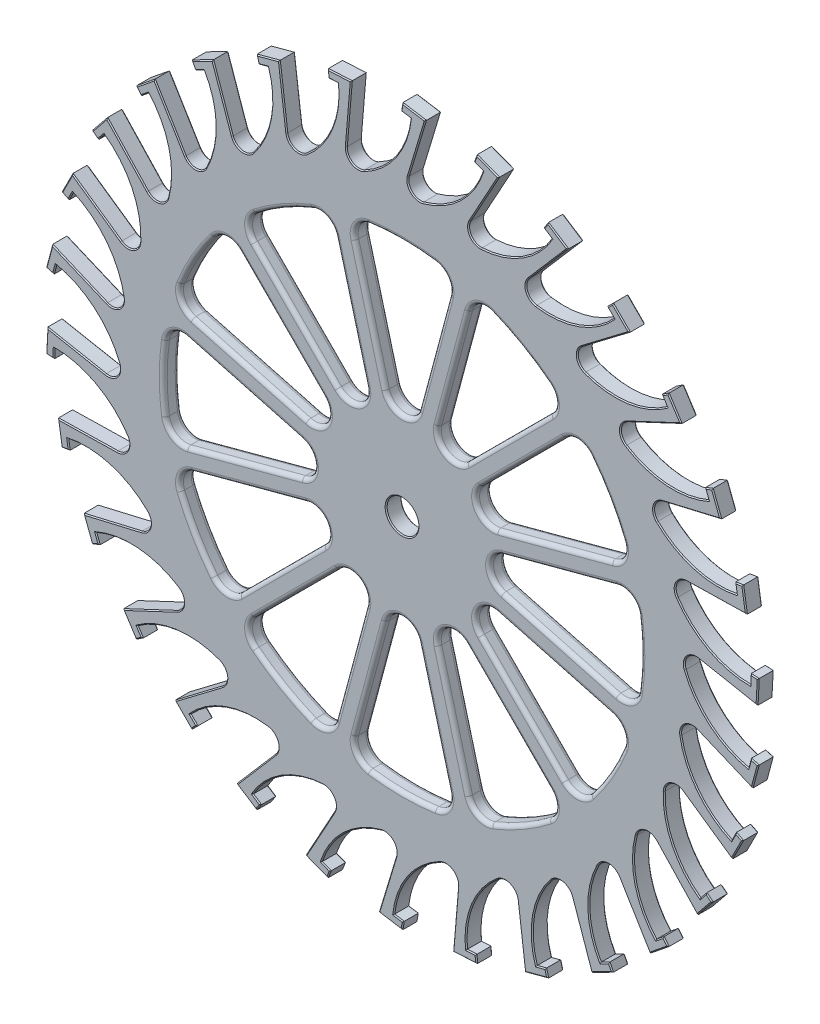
SolidWorks part; units mm, degrees
ref_plane "Спереди" through (0, 0, 0) normal (0, 0, 1) x (1, 0, 0)
ref_plane "Сверху" through (0, 0, 0) normal (0, 1, 0) x (1, 0, 0)
ref_plane "Справа" through (0, 0, 0) normal (1, 0, 0) x (0, 0, -1)
sketch "Эскиз1" plane through (0, 0, 0) normal (0, 0, 1) x (1, 0, 0)
  line L0 (0, 0) -> (0, -90) construction
  line L1 (-4.1625, -25.194) -> (-11.8833, -54.0084)
  line L2 (4.1625, -25.194) -> (11.8833, -54.0084)
  line L3 (-16.2019, -19.7374) -> (-37.2955, -40.831)
  line L4 (-8.9922, -23.8999) -> (-16.713, -52.7143)
  line L5 (-23.8999, -8.9922) -> (-52.7143, -16.713)
  line L6 (-19.7374, -16.2019) -> (-40.831, -37.2955)
  line L7 (-25.194, 4.1625) -> (-54.0084, 11.8833)
  line L8 (-25.194, -4.1625) -> (-54.0084, -11.8833)
  line L9 (-19.7374, 16.2019) -> (-40.831, 37.2955)
  line L10 (-23.8999, 8.9922) -> (-52.7143, 16.713)
  line L11 (-8.9922, 23.8999) -> (-16.713, 52.7143)
  line L12 (-16.2019, 19.7374) -> (-37.2955, 40.831)
  line L13 (4.1625, 25.194) -> (11.8833, 54.0084)
  line L14 (-4.1625, 25.194) -> (-11.8833, 54.0084)
  line L15 (16.2019, 19.7374) -> (37.2955, 40.831)
  line L16 (8.9922, 23.8999) -> (16.713, 52.7143)
  line L17 (23.8999, 8.9922) -> (52.7143, 16.713)
  line L18 (19.7374, 16.2019) -> (40.831, 37.2955)
  line L19 (25.194, -4.1625) -> (54.0084, -11.8833)
  line L20 (25.194, 4.1625) -> (54.0084, 11.8833)
  line L21 (19.7374, -16.2019) -> (40.831, -37.2955)
  line L22 (23.8999, -8.9922) -> (52.7143, -16.713)
  line L23 (8.9922, -23.8999) -> (16.713, -52.7143)
  line L24 (16.2019, -19.7374) -> (37.2955, -40.831)
  line L25 (-5.907, -89.0644) -> (-1.5801, -74.733)
  line L26 (-5.907, -89.0644) -> (0, -90)
  line L27 (0, -90) -> (0.3129, -88.0246)
  line L28 (0, -79.4534) -> (-3.0389, -89.5187) construction
  line L29 (0.3129, -88.0246) -> (-2.0816, -87.6454)
  line L30 (-24.2955, -85.89) -> (-17.0835, -72.7714)
  line L31 (-24.2955, -85.89) -> (-18.7121, -88.0333)
  line L32 (-18.7121, -88.0333) -> (-17.9953, -86.1661)
  line L33 (-17.9953, -86.1661) -> (-20.2586, -85.2973)
  line L34 (-16.5193, -77.7171) -> (-21.5845, -86.9307) construction
  line L35 (-41.6221, -78.9618) -> (-31.8402, -67.6293)
  line L36 (-41.6221, -78.9618) -> (-36.6063, -82.2191)
  line L37 (-36.6063, -82.2191) -> (-35.517, -80.5418)
  line L38 (-35.517, -80.5418) -> (-37.5502, -79.2214)
  line L39 (-32.3166, -72.5842) -> (-39.1867, -80.5434) construction
  line L40 (-57.1296, -68.5826) -> (-45.2053, -59.5315)
  line L41 (-57.1296, -68.5826) -> (-52.9007, -72.8115)
  line L42 (-52.9007, -72.8115) -> (-51.4865, -71.3973)
  line L43 (-51.4865, -71.3973) -> (-53.2007, -69.6831)
  line L44 (-46.7015, -64.2791) -> (-55.0763, -70.6359) construction
  line L45 (-70.1403, -55.206) -> (-56.5948, -48.8319)
  line L46 (-70.1403, -55.206) -> (-66.883, -60.2218)
  line L47 (-66.883, -60.2218) -> (-65.2057, -59.1325)
  line L48 (-65.2057, -59.1325) -> (-66.5261, -57.0993)
  line L49 (-59.0453, -53.1647) -> (-68.5588, -57.6413) construction
  line L50 (-80.0856, -39.4166) -> (-65.5108, -35.9981)
  line L51 (-80.0856, -39.4166) -> (-77.9423, -45)
  line L52 (-77.9423, -45) -> (-76.0751, -44.2833)
  line L53 (-76.0751, -44.2833) -> (-76.9439, -42.02)
  line L54 (-68.8086, -39.7267) -> (-79.0449, -42.1276) construction
  line L55 (-86.5307, -21.9045) -> (-71.5636, -21.591)
  line L56 (-86.5307, -21.9045) -> (-85.5951, -27.8115)
  line L57 (-85.5951, -27.8115) -> (-83.6197, -27.4987)
  line L58 (-83.6197, -27.4987) -> (-83.999, -25.1042)
  line L59 (-75.5646, -24.5524) -> (-86.0764, -24.7726) construction
  line L60 (-89.194, -3.4351) -> (-74.4888, -6.2403)
  line L61 (-89.194, -3.4351) -> (-89.507, -9.4076)
  line L62 (-89.507, -9.4076) -> (-87.5097, -9.5122)
  line L63 (-87.5097, -9.5122) -> (-87.3828, -7.0912)
  line L64 (-79.0181, -8.3051) -> (-89.3459, -6.335) construction
  line L65 (-87.9591, 15.1844) -> (-74.1585, 9.3832)
  line L66 (-87.9591, 15.1844) -> (-89.507, 9.4076)
  line L67 (-89.507, 9.4076) -> (-87.5751, 8.8899)
  line L68 (-87.5751, 8.8899) -> (-86.9477, 11.2316)
  line L69 (-79.0181, 8.3051) -> (-88.7106, 12.3795) construction
  line L70 (-82.8799, 33.1403) -> (-70.5871, 24.5966)
  line L71 (-82.8799, 33.1403) -> (-85.5951, 27.8115)
  line L72 (-85.5951, 27.8115) -> (-83.8131, 26.9035)
  line L73 (-83.8131, 26.9035) -> (-82.7125, 29.0636)
  line L74 (-75.5646, 24.5524) -> (-84.1983, 30.553) construction
  line L75 (-74.1785, 49.6478) -> (-63.9307, 38.735)
  line L76 (-74.1785, 49.6478) -> (-77.9423, 45)
  line L77 (-77.9423, 45) -> (-76.388, 43.7414)
  line L78 (-76.388, 43.7414) -> (-74.8623, 45.6254)
  line L79 (-68.8086, 39.7267) -> (-76.006, 47.3911) construction
  line L80 (-62.2352, 63.9855) -> (-54.4802, 51.1804)
  line L81 (-62.2352, 63.9855) -> (-66.883, 60.2218)
  line L82 (-66.883, 60.2218) -> (-65.6244, 58.6675)
  line L83 (-65.6244, 58.6675) -> (-63.7403, 60.1931)
  line L84 (-59.0453, 53.1647) -> (-64.4919, 62.158) construction
  line L85 (-47.5719, 75.5267) -> (-42.6486, 61.3891)
  line L86 (-47.5719, 75.5267) -> (-52.9007, 72.8115)
  line L87 (-52.9007, 72.8115) -> (-51.9927, 71.0295)
  line L88 (-51.9927, 71.0295) -> (-49.8326, 72.1301)
  line L89 (-46.7015, 64.2791) -> (-50.1592, 74.2084) construction
  line L90 (-30.8294, 83.767) -> (-28.9532, 68.9147)
  line L91 (-30.8294, 83.767) -> (-36.6063, 82.2191)
  line L92 (-36.6063, 82.2191) -> (-36.0887, 80.2872)
  line L93 (-36.0887, 80.2872) -> (-33.747, 80.9147)
  line L94 (-32.3166, 72.5842) -> (-33.6344, 83.0154) construction
  line L95 (-12.7396, 88.3463) -> (-13.9923, 73.4285)
  line L96 (-12.7396, 88.3463) -> (-18.7121, 88.0333)
  line L97 (-18.7121, 88.0333) -> (-18.6074, 86.036)
  line L98 (-18.6074, 86.036) -> (-16.1864, 86.1629)
  line L99 (-16.5193, 77.7171) -> (-15.6395, 88.1943) construction
  line L100 (5.907, 89.0644) -> (1.5801, 74.733)
  line L101 (5.907, 89.0644) -> (0, 90)
  line L102 (0, 90) -> (-0.3129, 88.0246)
  line L103 (-0.3129, 88.0246) -> (2.0816, 87.6454)
  line L104 (0, 79.4534) -> (3.0389, 89.5187) construction
  line L105 (24.2955, 85.89) -> (17.0835, 72.7714)
  line L106 (24.2955, 85.89) -> (18.7121, 88.0333)
  line L107 (18.7121, 88.0333) -> (17.9953, 86.1661)
  line L108 (17.9953, 86.1661) -> (20.2586, 85.2973)
  line L109 (16.5193, 77.7171) -> (21.5845, 86.9307) construction
  line L110 (41.6221, 78.9618) -> (31.8402, 67.6293)
  line L111 (41.6221, 78.9618) -> (36.6063, 82.2191)
  line L112 (36.6063, 82.2191) -> (35.517, 80.5418)
  line L113 (35.517, 80.5418) -> (37.5502, 79.2214)
  line L114 (32.3166, 72.5842) -> (39.1867, 80.5434) construction
  line L115 (57.1296, 68.5826) -> (45.2053, 59.5315)
  line L116 (57.1296, 68.5826) -> (52.9007, 72.8115)
  line L117 (52.9007, 72.8115) -> (51.4865, 71.3973)
  line L118 (51.4865, 71.3973) -> (53.2007, 69.6831)
  line L119 (46.7015, 64.2791) -> (55.0763, 70.6359) construction
  line L120 (70.1403, 55.206) -> (56.5948, 48.8319)
  line L121 (70.1403, 55.206) -> (66.883, 60.2218)
  line L122 (66.883, 60.2218) -> (65.2057, 59.1325)
  line L123 (65.2057, 59.1325) -> (66.5261, 57.0993)
  line L124 (59.0453, 53.1647) -> (68.5588, 57.6413) construction
  line L125 (80.0856, 39.4166) -> (65.5108, 35.9981)
  line L126 (80.0856, 39.4166) -> (77.9423, 45)
  line L127 (77.9423, 45) -> (76.0751, 44.2833)
  line L128 (76.0751, 44.2833) -> (76.9439, 42.02)
  line L129 (68.8086, 39.7267) -> (79.0449, 42.1276) construction
  line L130 (86.5307, 21.9045) -> (71.5636, 21.591)
  line L131 (86.5307, 21.9045) -> (85.5951, 27.8115)
  line L132 (85.5951, 27.8115) -> (83.6197, 27.4987)
  line L133 (83.6197, 27.4987) -> (83.999, 25.1042)
  line L134 (75.5646, 24.5524) -> (86.0764, 24.7726) construction
  line L135 (89.194, 3.4351) -> (74.4888, 6.2403)
  line L136 (89.194, 3.4351) -> (89.507, 9.4076)
  line L137 (89.507, 9.4076) -> (87.5097, 9.5122)
  line L138 (87.5097, 9.5122) -> (87.3828, 7.0912)
  line L139 (79.0181, 8.3051) -> (89.3459, 6.335) construction
  line L140 (87.9591, -15.1844) -> (74.1585, -9.3832)
  line L141 (87.9591, -15.1844) -> (89.507, -9.4076)
  line L142 (89.507, -9.4076) -> (87.5751, -8.8899)
  line L143 (87.5751, -8.8899) -> (86.9477, -11.2316)
  line L144 (79.0181, -8.3051) -> (88.7106, -12.3795) construction
  line L145 (82.8799, -33.1403) -> (70.5871, -24.5966)
  line L146 (82.8799, -33.1403) -> (85.5951, -27.8115)
  line L147 (85.5951, -27.8115) -> (83.8131, -26.9035)
  line L148 (83.8131, -26.9035) -> (82.7125, -29.0636)
  line L149 (75.5646, -24.5524) -> (84.1983, -30.553) construction
  line L150 (74.1785, -49.6478) -> (63.9307, -38.735)
  line L151 (74.1785, -49.6478) -> (77.9423, -45)
  line L152 (77.9423, -45) -> (76.388, -43.7414)
  line L153 (76.388, -43.7414) -> (74.8623, -45.6254)
  line L154 (68.8086, -39.7267) -> (76.006, -47.3911) construction
  line L155 (62.2352, -63.9855) -> (54.4802, -51.1804)
  line L156 (62.2352, -63.9855) -> (66.883, -60.2218)
  line L157 (66.883, -60.2218) -> (65.6244, -58.6675)
  line L158 (65.6244, -58.6675) -> (63.7403, -60.1931)
  line L159 (59.0453, -53.1647) -> (64.4919, -62.158) construction
  line L160 (47.5719, -75.5267) -> (42.6486, -61.3891)
  line L161 (47.5719, -75.5267) -> (52.9007, -72.8115)
  line L162 (52.9007, -72.8115) -> (51.9927, -71.0295)
  line L163 (51.9927, -71.0295) -> (49.8326, -72.1301)
  line L164 (46.7015, -64.2791) -> (50.1592, -74.2084) construction
  line L165 (30.8294, -83.767) -> (28.9532, -68.9147)
  line L166 (30.8294, -83.767) -> (36.6063, -82.2191)
  line L167 (36.6063, -82.2191) -> (36.0887, -80.2872)
  line L168 (36.0887, -80.2872) -> (33.747, -80.9147)
  line L169 (32.3166, -72.5842) -> (33.6344, -83.0154) construction
  line L170 (12.7396, -88.3463) -> (13.9923, -73.4285)
  line L171 (12.7396, -88.3463) -> (18.7121, -88.0333)
  line L172 (18.7121, -88.0333) -> (18.6074, -86.036)
  line L173 (18.6074, -86.036) -> (16.1864, -86.1629)
  line L174 (16.5193, -77.7171) -> (15.6395, -88.1943) construction
  circle A0 centre (0, 0) radius 4
  circle A1 centre (0, 0) radius 22 construction
  arc A2 (-8.2954, -59.4238) -> (8.2954, -59.4238) centre (0, 0) ccw
  circle A3 centre (0, 0) radius 90 construction
  arc A4 (4.1625, -25.194) -> (-4.1625, -25.194) centre (0, -26.3094) ccw
  arc A5 (-11.8833, -54.0084) -> (-8.2954, -59.4238) centre (-7.696, -55.1304) ccw
  arc A6 (11.8833, -54.0084) -> (8.2954, -59.4238) centre (7.696, -55.1304) cw
  arc A7 (-8.9922, -23.8999) -> (-16.2019, -19.7374) centre (-13.1547, -22.7846) ccw
  arc A8 (-37.2955, -40.831) -> (-36.8959, -47.3148) centre (-34.2302, -43.8963) ccw
  arc A9 (-36.8959, -47.3148) -> (-22.5279, -55.6102) centre (0, 0) ccw
  arc A10 (-16.713, -52.7143) -> (-22.5279, -55.6102) centre (-20.9002, -51.5924) cw
  arc A11 (-19.7374, -16.2019) -> (-23.8999, -8.9922) centre (-22.7846, -13.1547) ccw
  arc A12 (-52.7143, -16.713) -> (-55.6102, -22.5279) centre (-51.5924, -20.9002) ccw
  arc A13 (-55.6102, -22.5279) -> (-47.3148, -36.8959) centre (0, 0) ccw
  arc A14 (-40.831, -37.2955) -> (-47.3148, -36.8959) centre (-43.8963, -34.2302) cw
  arc A15 (-25.194, -4.1625) -> (-25.194, 4.1625) centre (-26.3094, 0) ccw
  arc A16 (-54.0084, 11.8833) -> (-59.4238, 8.2954) centre (-55.1304, 7.696) ccw
  arc A17 (-59.4238, 8.2954) -> (-59.4238, -8.2954) centre (0, 0) ccw
  arc A18 (-54.0084, -11.8833) -> (-59.4238, -8.2954) centre (-55.1304, -7.696) cw
  arc A19 (-23.8999, 8.9922) -> (-19.7374, 16.2019) centre (-22.7846, 13.1547) ccw
  arc A20 (-40.831, 37.2955) -> (-47.3148, 36.8959) centre (-43.8963, 34.2302) ccw
  arc A21 (-47.3148, 36.8959) -> (-55.6102, 22.5279) centre (0, 0) ccw
  arc A22 (-52.7143, 16.713) -> (-55.6102, 22.5279) centre (-51.5924, 20.9002) cw
  arc A23 (-16.2019, 19.7374) -> (-8.9922, 23.8999) centre (-13.1547, 22.7846) ccw
  arc A24 (-16.713, 52.7143) -> (-22.5279, 55.6102) centre (-20.9002, 51.5924) ccw
  arc A25 (-22.5279, 55.6102) -> (-36.8959, 47.3148) centre (0, 0) ccw
  arc A26 (-37.2955, 40.831) -> (-36.8959, 47.3148) centre (-34.2302, 43.8963) cw
  arc A27 (-4.1625, 25.194) -> (4.1625, 25.194) centre (0, 26.3094) ccw
  arc A28 (11.8833, 54.0084) -> (8.2954, 59.4238) centre (7.696, 55.1304) ccw
  arc A29 (8.2954, 59.4238) -> (-8.2954, 59.4238) centre (0, 0) ccw
  arc A30 (-11.8833, 54.0084) -> (-8.2954, 59.4238) centre (-7.696, 55.1304) cw
  arc A31 (8.9922, 23.8999) -> (16.2019, 19.7374) centre (13.1547, 22.7846) ccw
  arc A32 (37.2955, 40.831) -> (36.8959, 47.3148) centre (34.2302, 43.8963) ccw
  arc A33 (36.8959, 47.3148) -> (22.5279, 55.6102) centre (0, 0) ccw
  arc A34 (16.713, 52.7143) -> (22.5279, 55.6102) centre (20.9002, 51.5924) cw
  arc A35 (19.7374, 16.2019) -> (23.8999, 8.9922) centre (22.7846, 13.1547) ccw
  arc A36 (52.7143, 16.713) -> (55.6102, 22.5279) centre (51.5924, 20.9002) ccw
  arc A37 (55.6102, 22.5279) -> (47.3148, 36.8959) centre (0, 0) ccw
  arc A38 (40.831, 37.2955) -> (47.3148, 36.8959) centre (43.8963, 34.2302) cw
  arc A39 (25.194, 4.1625) -> (25.194, -4.1625) centre (26.3094, 0) ccw
  arc A40 (54.0084, -11.8833) -> (59.4238, -8.2954) centre (55.1304, -7.696) ccw
  arc A41 (59.4238, -8.2954) -> (59.4238, 8.2954) centre (0, 0) ccw
  arc A42 (54.0084, 11.8833) -> (59.4238, 8.2954) centre (55.1304, 7.696) cw
  arc A43 (23.8999, -8.9922) -> (19.7374, -16.2019) centre (22.7846, -13.1547) ccw
  arc A44 (40.831, -37.2955) -> (47.3148, -36.8959) centre (43.8963, -34.2302) ccw
  arc A45 (47.3148, -36.8959) -> (55.6102, -22.5279) centre (0, 0) ccw
  arc A46 (52.7143, -16.713) -> (55.6102, -22.5279) centre (51.5924, -20.9002) cw
  arc A47 (16.2019, -19.7374) -> (8.9922, -23.8999) centre (13.1547, -22.7846) ccw
  arc A48 (16.713, -52.7143) -> (22.5279, -55.6102) centre (20.9002, -51.5924) ccw
  arc A49 (22.5279, -55.6102) -> (36.8959, -47.3148) centre (0, 0) ccw
  arc A50 (37.2955, -40.831) -> (36.8959, -47.3148) centre (34.2302, -43.8963) cw
  circle A51 centre (0, 0) radius 74 construction
  arc A52 (-1.5801, -74.733) -> (-5.2561, -70.9757) centre (-4.4521, -73.866) ccw
  arc A53 (9.6154, -70.5175) -> (-2.0816, -87.6454) centre (19.7895, -90.0236) ccw
  arc A54 (-17.0835, -72.7714) -> (-19.8979, -68.3319) centre (-19.7124, -71.3262) ccw
  arc A55 (-5.2561, -70.9757) -> (-20.2586, -85.2973) centre (0.6401, -92.1709) ccw
  arc A56 (-31.8402, -67.6293) -> (-33.6701, -62.7017) centre (-34.1112, -65.6691) ccw
  arc A57 (-19.8979, -68.3319) -> (-37.5502, -79.2214) centre (-18.5373, -90.2898) ccw
  arc A58 (-45.2053, -59.5315) -> (-45.9707, -54.3311) centre (-47.0191, -57.1419) ccw
  arc A59 (-33.6701, -62.7017) -> (-53.2007, -69.6831) centre (-36.9045, -84.4626) ccw
  arc A60 (-56.5948, -48.8319) -> (-56.2622, -43.586) centre (-57.8721, -46.1174) ccw
  arc A61 (-45.9707, -54.3311) -> (-66.5261, -57.0993) centre (-53.6589, -74.944) ccw
  arc A62 (-65.5108, -35.9981) -> (-64.0948, -30.9359) centre (-66.1958, -33.0774) ccw
  arc A63 (-56.2622, -43.586) -> (-76.9439, -42.02) centre (-68.068, -62.15) ccw
  arc A64 (-71.5636, -21.591) -> (-69.1261, -16.9338) centre (-71.6265, -18.5917) ccw
  arc A65 (-64.0948, -30.9359) -> (-83.999, -25.1042) centre (-79.5023, -46.6397) ccw
  arc A66 (-74.4888, -6.2403) -> (-71.1363, -2.1917) centre (-73.9267, -3.2934) ccw
  arc A67 (-69.1261, -16.9338) -> (-87.3828, -7.0912) centre (-87.4619, -29.0911) ccw
  arc A68 (-74.1585, 9.3832) -> (-70.0375, 12.6463) centre (-72.9959, 12.1488) ccw
  arc A69 (-71.1363, -2.1917) -> (-86.9477, 11.2316) centre (-91.599, -10.271) ccw
  arc A70 (-70.5871, 24.5966) -> (-65.8777, 26.9315) centre (-68.8749, 27.06) ccw
  arc A71 (-70.0375, 12.6463) -> (-82.7125, 29.0636) centre (-91.7329, 8.9979) ccw
  arc A72 (-63.9307, 38.735) -> (-58.8387, 40.0398) centre (-61.7438, 40.7886) ccw
  arc A73 (-65.8777, 26.9315) -> (-74.8623, 45.6254) centre (-87.8575, 27.8736) ccw
  arc A74 (-54.4802, 51.1804) -> (-49.2282, 51.3981) centre (-51.9141, 52.7345) ccw
  arc A75 (-58.8387, 40.0398) -> (-63.7403, 60.1931) centre (-80.1423, 45.5311) ccw
  arc A76 (-42.6486, 61.3891) -> (-37.4662, 60.51) centre (-39.8155, 62.3757) ccw
  arc A77 (-49.2282, 51.3981) -> (-49.8326, 72.1301) centre (-68.9246, 61.1987) ccw
  arc A78 (-28.9532, 68.9147) -> (-24.0667, 66.9774) centre (-25.9768, 69.2907) ccw
  arc A79 (-37.4662, 60.51) -> (-33.747, 80.9147) centre (-54.6945, 74.1916) ccw
  arc A80 (-13.9923, 73.4285) -> (-9.6154, 70.5175) centre (-11.0028, 73.1774) ccw
  arc A81 (-24.0667, 66.9774) -> (-16.1864, 86.1629) centre (-38.074, 83.9419) ccw
  arc A82 (1.5801, 74.733) -> (5.2561, 70.9757) centre (4.4521, 73.866) ccw
  arc A83 (-9.6154, 70.5175) -> (2.0816, 87.6454) centre (-19.7895, 90.0236) ccw
  arc A84 (17.0835, 72.7714) -> (19.8979, 68.3319) centre (19.7124, 71.3262) ccw
  arc A85 (5.2561, 70.9757) -> (20.2586, 85.2973) centre (-0.6401, 92.1709) ccw
  arc A86 (31.8402, 67.6293) -> (33.6701, 62.7017) centre (34.1112, 65.6691) ccw
  arc A87 (19.8979, 68.3319) -> (37.5502, 79.2214) centre (18.5373, 90.2898) ccw
  arc A88 (45.2053, 59.5315) -> (45.9707, 54.3311) centre (47.0191, 57.1419) ccw
  arc A89 (33.6701, 62.7017) -> (53.2007, 69.6831) centre (36.9045, 84.4626) ccw
  arc A90 (56.5948, 48.8319) -> (56.2622, 43.586) centre (57.8721, 46.1174) ccw
  arc A91 (45.9707, 54.3311) -> (66.5261, 57.0993) centre (53.6589, 74.944) ccw
  arc A92 (65.5108, 35.9981) -> (64.0948, 30.9359) centre (66.1958, 33.0774) ccw
  arc A93 (56.2622, 43.586) -> (76.9439, 42.02) centre (68.068, 62.15) ccw
  arc A94 (71.5636, 21.591) -> (69.1261, 16.9338) centre (71.6265, 18.5917) ccw
  arc A95 (64.0948, 30.9359) -> (83.999, 25.1042) centre (79.5023, 46.6397) ccw
  arc A96 (74.4888, 6.2403) -> (71.1363, 2.1917) centre (73.9267, 3.2934) ccw
  arc A97 (69.1261, 16.9338) -> (87.3828, 7.0912) centre (87.4619, 29.0911) ccw
  arc A98 (74.1585, -9.3832) -> (70.0375, -12.6463) centre (72.9959, -12.1488) ccw
  arc A99 (71.1363, 2.1917) -> (86.9477, -11.2316) centre (91.599, 10.271) ccw
  arc A100 (70.5871, -24.5966) -> (65.8777, -26.9315) centre (68.8749, -27.06) ccw
  arc A101 (70.0375, -12.6463) -> (82.7125, -29.0636) centre (91.7329, -8.9979) ccw
  arc A102 (63.9307, -38.735) -> (58.8387, -40.0398) centre (61.7438, -40.7886) ccw
  arc A103 (65.8777, -26.9315) -> (74.8623, -45.6254) centre (87.8575, -27.8736) ccw
  arc A104 (54.4802, -51.1804) -> (49.2282, -51.3981) centre (51.9141, -52.7345) ccw
  arc A105 (58.8387, -40.0398) -> (63.7403, -60.1931) centre (80.1423, -45.5311) ccw
  arc A106 (42.6486, -61.3891) -> (37.4662, -60.51) centre (39.8155, -62.3757) ccw
  arc A107 (49.2282, -51.3981) -> (49.8326, -72.1301) centre (68.9246, -61.1987) ccw
  arc A108 (28.9532, -68.9147) -> (24.0667, -66.9774) centre (25.9768, -69.2907) ccw
  arc A109 (37.4662, -60.51) -> (33.747, -80.9147) centre (54.6945, -74.1916) ccw
  arc A110 (13.9923, -73.4285) -> (9.6154, -70.5175) centre (11.0028, -73.1774) ccw
  arc A111 (24.0667, -66.9774) -> (16.1864, -86.1629) centre (38.074, -83.9419) ccw
  circle A112 centre (0, 0) radius 92.1731 construction
  dimension "D1" = 8
  dimension "D2" = 44
  dimension "D3" = 120
  dimension "D4" = 180
  dimension "D5" = 8.67
  dimension "D6" = 12
  dimension "D8" = 148
  dimension "D10" = 6
  dimension "D14" = 44
  dimension "D16" = 184.3462
  dimension "D7" = 5
  dimension "D9" = 16.8
  dimension "D11" = 82.2
  dimension "D12" = 2.877
  dimension "D13" = 2
  dimension "D15" = 30
extrude "Бобышка-Вытянуть1" add sketch "Эскиз1" along normal mid plane 4
fillet "Скругление1" radius 1 122 edges at (-8.0229, 39.6012, 2) (-11.3098, 57.5247, 2) (0, 60, 2) (8.0229, 39.6012, 2) (-8.0229, 39.6012, -2) (0, 60, -2) (8.0229, 39.6012, -2) (18.9678, 55.4728, 2) (30, 51.9615, 2) (38.557, 44.163, 2) (26.7487, 30.2842, 2) (12.8526, 38.3071, -2) (18.9678, 55.4728, -2) (30, 51.9615, -2) (38.557, 44.163, -2) (26.7487, 30.2842, -2) (30.2842, 26.7487, 2) (44.163, 38.557, 2) (51.9615, 30, 2) (55.4728, 18.9678, 2) (38.3071, 12.8526, 2) (30.2842, 26.7487, -2) (44.163, 38.557, -2) (51.9615, 30, -2) (55.4728, 18.9678, -2) (38.3071, 12.8526, -2) (22, 0, 2) (39.6012, 8.0229, 2) (60, 0, 2) (57.5247, -11.3098, 2) (39.6012, 8.0229, -2) (57.5247, 11.3098, -2) (60, 0, -2) (38.3071, -12.8526, 2) (55.4728, -18.9678, 2) (51.9615, -30, 2) (44.163, -38.557, 2) (19.0526, -11, -2) (38.3071, -12.8526, -2) (55.4728, -18.9678, -2) (51.9615, -30, -2) (44.163, -38.557, -2) (11, -19.0526, 2) (26.7487, -30.2842, 2) (38.557, -44.163, 2) (30, -51.9615, 2) (18.9678, -55.4728, 2) (26.7487, -30.2842, -2) (38.557, -44.163, -2) (30, -51.9615, -2) (18.9678, -55.4728, -2) (0, -22, 2) (8.0229, -39.6012, 2) (11.3098, -57.5247, 2) (-8.0229, -39.6012, -2) (0, -22, -2) (8.0229, -39.6012, -2) (11.3098, -57.5247, -2) (-38.557, -44.163, 2) (-26.7487, -30.2842, 2) (-11, -19.0526, 2) (-12.8526, -38.3071, 2) (-18.9678, -55.4728, 2) (-38.557, -44.163, -2) (-26.7487, -30.2842, -2) (-11, -19.0526, -2) (-12.8526, -38.3071, -2) (-18.9678, -55.4728, -2) (-55.4728, -18.9678, 2) (-38.3071, -12.8526, 2) (-19.0526, -11, 2) (-30.2842, -26.7487, 2) (-44.163, -38.557, 2) (-19.0526, -11, -2) (-30.2842, -26.7487, -2) (-60, 0, 2) (-57.5247, 11.3098, 2) (-22, 0, 2) (-57.5247, -11.3098, -2) (-60, 0, -2) (-57.5247, 11.3098, -2) (-39.6012, 8.0229, -2) (-22, 0, -2) (-55.4728, 18.9678, 2) (-51.9615, 30, 2) (-44.163, 38.557, 2) (-30.2842, 26.7487, 2) (-19.0526, 11, 2) (-55.4728, 18.9678, -2) (-51.9615, 30, -2) (-44.163, 38.557, -2) (-30.2842, 26.7487, -2) (-19.0526, 11, -2) (-38.557, 44.163, 2) (-30, 51.9615, 2) (-12.8526, 38.3071, 2) (-11, 19.0526, 2) (-38.557, 44.163, -2) (-30, 51.9615, -2) (-18.9678, 55.4728, -2) (-12.8526, 38.3071, -2) (-11, 19.0526, -2) (0, 22, 2) (0, 22, -2) (11, 19.0526, 2) (11, 19.0526, -2) (19.0526, 11, 2) (19.0526, 11, -2) (39.6012, -8.0229, 2) (39.6012, -8.0229, -2) (30.2842, -26.7487, 2) (30.2842, -26.7487, -2) (12.8526, -38.3071, 2) (12.8526, -38.3071, -2) (0, -60, -2) (-30, -51.9615, 2) (-30, -51.9615, -2) (-51.9615, -30, 2) (-51.9615, -30, -2) (-38.3071, 12.8526, 2) (-38.3071, 12.8526, -2) (-26.7487, 30.2842, 2)
chamfer "Фаска1" distance 0.25 angle 45 362 edges at (4, 0, -2) (-0.8844, -87.835, -2) (1.6218, -77.6165, -2) (12.6642, -70.6795, -2) (13.3659, -80.8874, -2) (15.7258, -88.1898, -2) (18.6597, -87.0347, -2) (17.3969, -86.0995, -2) (17.7238, -75.5832, -2) (27.0825, -66.5019, -2) (29.8913, -76.3409, -2) (33.7179, -82.993, -2) (36.3475, -81.2532, -2) (34.9178, -80.601, -2) (33.0511, -70.2466, -2) (40.3172, -59.4179, -2) (45.1103, -68.4579, -2) (50.2363, -74.1691, -2) (52.4467, -71.9205, -2) (50.9127, -71.5798, -2) (46.9339, -61.8398, -2) (51.7899, -49.7371, -2) (58.3577, -57.583, -2) (64.5591, -62.1036, -2) (66.2537, -59.4446, -2) (64.6824, -59.4303, -2) (58.7655, -50.7303, -2) (60.9991, -37.8825, -2) (69.0546, -44.1914, -2) (76.0604, -47.3239, -2) (77.1651, -44.3707, -2) (75.6252, -44.6834, -2) (68.0288, -37.4037, -2) (67.5423, -24.3722, -2) (76.7335, -28.8684, -2) (84.2375, -30.4759, -2) (84.7041, -27.3575, -2) (83.2628, -27.9836, -2) (74.3189, -22.4424, -2) (71.1336, -9.7968, -2) (81.0588, -12.2838, -2) (88.733, -12.296, -2) (88.541, -9.1487, -2) (87.2614, -10.0608, -2) (77.3609, -6.5002, -2) (71.616, 5.2068, -2) (81.8414, 4.8377, -2) (89.3505, 6.4213, -2) (88.5083, 9.4599, -2) (87.4463, 8.3017, -2) (77.0218, 9.7261, -2) (68.9685, 19.9828, -2) (79.0472, 21.7478, -2) (86.0629, 24.858, -2) (84.6074, 27.6551, -2) (83.8093, 26.3014, -2) (73.3165, 25.5273, -2) (63.3067, 33.8855, -2) (72.7982, 37.7073, -2) (79.0139, 42.2083, -2) (77.0087, 44.6416, -2) (76.5095, 43.1516, -2) (66.407, 40.2128, -2) (54.8781, 46.3072, -2) (63.3676, 52.0189, -2) (68.5117, 57.7139, -2) (66.0444, 59.6771, -2) (65.8659, 58.1159, -2) (56.5951, 53.1408, -2) (44.0511, 56.7051, -2) (51.1675, 64.0571, -2) (55.0152, 70.6971, -2) (52.1936, 72.1044, -2) (52.3436, 70.5402, -2) (44.3098, 63.7464, -2) (31.2988, 64.6247, -2) (36.7311, 73.2956, -2) (39.1142, 80.5904, -2) (36.0617, 81.3804, -2) (36.5336, 79.8816, -2) (30.0879, 71.5659, -2) (17.1786, 69.7199, -2) (20.6895, 79.3307, -2) (21.5038, 86.9616, -2) (18.3537, 87.0997, -2) (19.127, 85.7317, -2) (14.551, 76.2576, -2) (2.3077, 71.768, -2) (3.7436, 81.8987, -2) (2.9535, 89.5322, -2) (-0.1564, 89.0123, -2) (0.8844, 87.835, -2) (-1.6218, 77.6165, -2) (-12.6642, 70.6795, -2) (-13.3659, 80.8874, -2) (-15.7258, 88.1898, -2) (-18.6597, 87.0347, -2) (-17.3969, 86.0995, -2) (-17.7238, 75.5832, -2) (-27.0825, 66.5019, -2) (-29.8913, 76.3409, -2) (-33.7179, 82.993, -2) (-36.3475, 81.2532, -2) (-34.9178, 80.601, -2) (-33.0511, 70.2466, -2) (-40.3172, 59.4179, -2) (-45.1103, 68.4579, -2) (-50.2363, 74.1691, -2) (-52.4467, 71.9205, -2) (-50.9127, 71.5798, -2) (-46.9339, 61.8398, -2) (-51.7899, 49.7371, -2) (-58.3577, 57.583, -2) (-64.5591, 62.1036, -2) (-66.2537, 59.4446, -2) (-64.6824, 59.4303, -2) (-58.7655, 50.7303, -2) (-60.9991, 37.8825, -2) (-69.0546, 44.1914, -2) (-76.0604, 47.3239, -2) (-77.1651, 44.3707, -2) (-75.6252, 44.6834, -2) (-68.0288, 37.4037, -2) (-67.5423, 24.3722, -2) (-76.7335, 28.8684, -2) (-84.2375, 30.4759, -2) (-84.7041, 27.3575, -2) (-83.2628, 27.9836, -2) (-74.3189, 22.4424, -2) (-71.1336, 9.7968, -2) (-81.0588, 12.2838, -2) (-88.733, 12.296, -2) (-88.541, 9.1487, -2) (-87.2614, 10.0608, -2) (-77.3609, 6.5002, -2) (-71.616, -5.2068, -2) (-81.8414, -4.8377, -2) (-89.3505, -6.4213, -2) (-88.5083, -9.4599, -2) (-87.4463, -8.3017, -2) (-77.0218, -9.7261, -2) (-68.9685, -19.9828, -2) (-79.0472, -21.7478, -2) (-86.0629, -24.858, -2) (-84.6074, -27.6551, -2) (-83.8093, -26.3014, -2) (-73.3165, -25.5273, -2) (-63.3067, -33.8855, -2) (-72.7982, -37.7073, -2) (-79.0139, -42.2083, -2) (-77.0087, -44.6416, -2) (-76.5095, -43.1516, -2) (-66.407, -40.2128, -2) (-54.8781, -46.3072, -2) (-63.3676, -52.0189, -2) (-68.5117, -57.7139, -2) (-66.0444, -59.6771, -2) (-65.8659, -58.1159, -2) (-56.5951, -53.1408, -2) (-44.0511, -56.7051, -2) (-51.1675, -64.0571, -2) (-55.0152, -70.6971, -2) (-52.1936, -72.1044, -2) (-52.3436, -70.5402, -2) (-44.3098, -63.7464, -2) (-31.2988, -64.6247, -2) (-36.7311, -73.2956, -2) (-39.1142, -80.5904, -2) (-36.0617, -81.3804, -2) (-36.5336, -79.8816, -2) (-30.0879, -71.5659, -2) (-17.1786, -69.7199, -2) (-20.6895, -79.3307, -2) (-21.5038, -86.9616, -2) (-18.3537, -87.0997, -2) (-19.127, -85.7317, -2) (-14.551, -76.2576, -2) (-2.3077, -71.768, -2) (-3.7436, -81.8987, -2) (-2.9535, -89.5322, -2) (0.1564, -89.0123, -2) (4, 0, 2) (-2.9535, -89.5322, 2) (-3.7436, -81.8987, 2) (-2.3077, -71.768, 2) (-14.551, -76.2576, 2) (-19.127, -85.7317, 2) (-18.3537, -87.0997, 2) (-21.5038, -86.9616, 2) (-20.6895, -79.3307, 2) (-17.1786, -69.7199, 2) (-30.0879, -71.5659, 2) (-36.5336, -79.8816, 2) (-36.0617, -81.3804, 2) (-39.1142, -80.5904, 2) (-36.7311, -73.2956, 2) (-31.2988, -64.6247, 2) (-44.3098, -63.7464, 2) (-52.3436, -70.5402, 2) (-52.1936, -72.1044, 2) (-55.0152, -70.6971, 2) (-51.1675, -64.0571, 2) (-44.0511, -56.7051, 2) (-56.5951, -53.1408, 2) (-65.8659, -58.1159, 2) (-66.0444, -59.6771, 2) (-68.5117, -57.7139, 2) (-63.3676, -52.0189, 2) (-54.8781, -46.3072, 2) (-66.407, -40.2128, 2) (-76.5095, -43.1516, 2) (-77.0087, -44.6416, 2) (-79.0139, -42.2083, 2) (-72.7982, -37.7073, 2) (-63.3067, -33.8855, 2) (-73.3165, -25.5273, 2) (-83.8093, -26.3014, 2) (-84.6074, -27.6551, 2) (-86.0629, -24.858, 2) (-79.0472, -21.7478, 2) (-68.9685, -19.9828, 2) (-77.0218, -9.7261, 2) (-87.4463, -8.3017, 2) (-88.5083, -9.4599, 2) (-89.3505, -6.4213, 2) (-81.8414, -4.8377, 2) (-71.616, -5.2068, 2) (-77.3609, 6.5002, 2) (-87.2614, 10.0608, 2) (-88.541, 9.1487, 2) (-88.733, 12.296, 2) (-81.0588, 12.2838, 2) (-71.1336, 9.7968, 2) (-74.3189, 22.4424, 2) (-83.2628, 27.9836, 2) (-84.7041, 27.3575, 2) (-84.2375, 30.4759, 2) (-76.7335, 28.8684, 2) (-67.5423, 24.3722, 2) (-68.0288, 37.4037, 2) (-75.6252, 44.6834, 2) (-77.1651, 44.3707, 2) (-76.0604, 47.3239, 2) (-69.0546, 44.1914, 2) (-60.9991, 37.8825, 2) (-58.7655, 50.7303, 2) (-64.6824, 59.4303, 2) (-66.2537, 59.4446, 2) (-64.5591, 62.1036, 2) (-58.3577, 57.583, 2) (-51.7899, 49.7371, 2) (-46.9339, 61.8398, 2) (-50.9127, 71.5798, 2) (-52.4467, 71.9205, 2) (-50.2363, 74.1691, 2) (-45.1103, 68.4579, 2) (-40.3172, 59.4179, 2) (-33.0511, 70.2466, 2) (-34.9178, 80.601, 2) (-36.3475, 81.2532, 2) (-33.7179, 82.993, 2) (-29.8913, 76.3409, 2) (-27.0825, 66.5019, 2) (-17.7238, 75.5832, 2) (-17.3969, 86.0995, 2) (-18.6597, 87.0347, 2) (-15.7258, 88.1898, 2) (-13.3659, 80.8874, 2) (-12.6642, 70.6795, 2) (-1.6218, 77.6165, 2) (0.8844, 87.835, 2) (-0.1564, 89.0123, 2) (2.9535, 89.5322, 2) (3.7436, 81.8987, 2) (2.3077, 71.768, 2) (14.551, 76.2576, 2) (19.127, 85.7317, 2) (18.3537, 87.0997, 2) (21.5038, 86.9616, 2) (20.6895, 79.3307, 2) (17.1786, 69.7199, 2) (30.0879, 71.5659, 2) (36.5336, 79.8816, 2) (36.0617, 81.3804, 2) (39.1142, 80.5904, 2) (36.7311, 73.2956, 2) (31.2988, 64.6247, 2) (44.3098, 63.7464, 2) (52.3436, 70.5402, 2) (52.1936, 72.1044, 2) (55.0152, 70.6971, 2) (51.1675, 64.0571, 2) (44.0511, 56.7051, 2) (56.5951, 53.1408, 2) (65.8659, 58.1159, 2) (66.0444, 59.6771, 2) (68.5117, 57.7139, 2) (63.3676, 52.0189, 2) (54.8781, 46.3072, 2) (66.407, 40.2128, 2) (76.5095, 43.1516, 2) (77.0087, 44.6416, 2) (79.0139, 42.2083, 2) (72.7982, 37.7073, 2) (63.3067, 33.8855, 2) (73.3165, 25.5273, 2) (83.8093, 26.3014, 2) (84.6074, 27.6551, 2) (86.0629, 24.858, 2) (79.0472, 21.7478, 2) (68.9685, 19.9828, 2) (77.0218, 9.7261, 2) (87.4463, 8.3017, 2) (88.5083, 9.4599, 2) (89.3505, 6.4213, 2) (81.8414, 4.8377, 2) (71.616, 5.2068, 2) (77.3609, -6.5002, 2) (87.2614, -10.0608, 2) (88.541, -9.1487, 2) (88.733, -12.296, 2) (81.0588, -12.2838, 2) (71.1336, -9.7968, 2) (74.3189, -22.4424, 2) (83.2628, -27.9836, 2) (84.7041, -27.3575, 2) (84.2375, -30.4759, 2) (76.7335, -28.8684, 2) (67.5423, -24.3722, 2) (68.0288, -37.4037, 2) (75.6252, -44.6834, 2) (77.1651, -44.3707, 2) (76.0604, -47.3239, 2) (69.0546, -44.1914, 2) (60.9991, -37.8825, 2) (58.7655, -50.7303, 2) (64.6824, -59.4303, 2) (66.2537, -59.4446, 2) (64.5591, -62.1036, 2) (58.3577, -57.583, 2) (51.7899, -49.7371, 2) (46.9339, -61.8398, 2) (50.9127, -71.5798, 2) (52.4467, -71.9205, 2) (50.2363, -74.1691, 2) (45.1103, -68.4579, 2) (40.3172, -59.4179, 2) (33.0511, -70.2466, 2) (34.9178, -80.601, 2) (36.3475, -81.2532, 2) (33.7179, -82.993, 2) (29.8913, -76.3409, 2) (27.0825, -66.5019, 2) (17.7238, -75.5832, 2) (17.3969, -86.0995, 2) (18.6597, -87.0347, 2) (15.7258, -88.1898, 2) (13.3659, -80.8874, 2) (12.6642, -70.6795, 2) (1.6218, -77.6165, 2) (-0.8844, -87.835, 2) (0.1564, -89.0123, 2)
